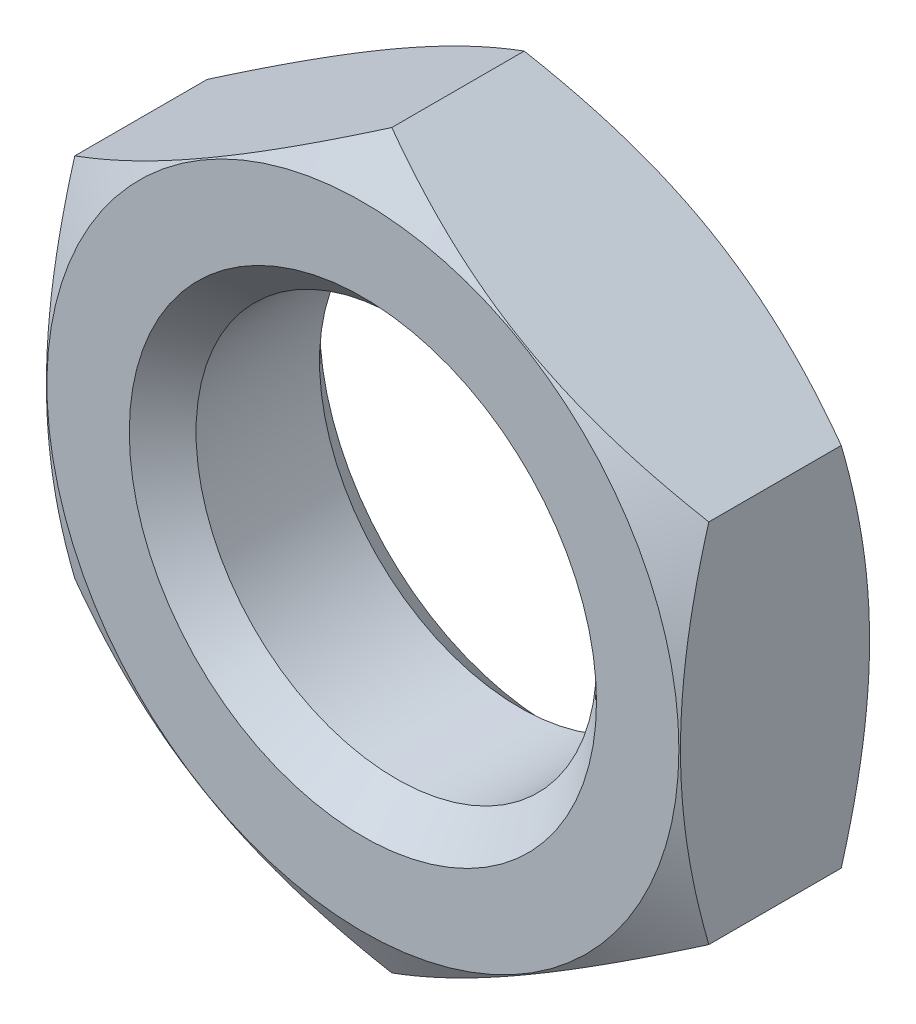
SolidWorks part; units mm, degrees
ref_plane "Front Plane" through (0, 0, 0) normal (0, 0, 1) x (1, 0, 0)
ref_plane "Top Plane" through (0, 0, 0) normal (0, 1, 0) x (1, 0, 0)
ref_plane "Right Plane" through (0, 0, 0) normal (1, 0, 0) x (0, 0, -1)
sketch "Sketch3" plane through (0, 0, 0) normal (0, 0, 1) x (1, 0, 0)
  line L1 (0, 10.9697) -> (-9.5, 5.4848)
  line L2 (-9.5, 5.4848) -> (-9.5, -5.4848)
  line L3 (-9.5, -5.4848) -> (0, -10.9697)
  line L4 (0, -10.9697) -> (9.5, -5.4848)
  line L5 (9.5, -5.4848) -> (9.5, 5.4848)
  line L6 (9.5, 5.4848) -> (0, 10.9697)
  circle A0 centre (0, 0) radius 9.5 construction
  dimension "D1" = 19
extrude "Boss-Extrude1" add sketch "Sketch3" along normal mid plane 5.7
sketch "Sketch4" plane through (0, 0, 0) normal (1, 0, 0) x (0, 0, -1)
  line L0 (-5.4578, 0) -> (6.1545, 0) construction
sketch "Sketch5" plane through (0, 0, 0) normal (1, 0, 0) x (0, 0, -1)
  line L0 (-2.85, 10.9697) -> (-2.85, 9.4697)
  line L1 (-2.85, 5.4848) -> (-2.85, 10.9697) construction
  line L2 (-2.85, 9.4697) -> (-1.984, 10.9697)
  line L3 (-2.85, 10.9697) -> (2.85, 10.9697) construction
  line L4 (-1.984, 10.9697) -> (-2.85, 10.9697)
  dimension "D1" = 1.5
  dimension "D2" = 30
revolve "Cut-Revolve1" cut sketch "Sketch5" angle 360 about L0
mirror "Mirror1" about plane through (0, 0, 0) normal (0, 0, 1) of "Cut-Revolve1"
sketch "Sketch6" plane through (0, 0, 2.85) normal (0, 0, 1) x (1, 0, 0)
  circle A0 centre (0, 0) radius 6
  dimension "D1" = 12
extrude "Cut-Extrude1" cut sketch "Sketch6" against normal blind 5.7
chamfer "Chamfer1" distance 1 angle 45 2 edges at (6, 0, -2.85) (6, 0, 2.85)
